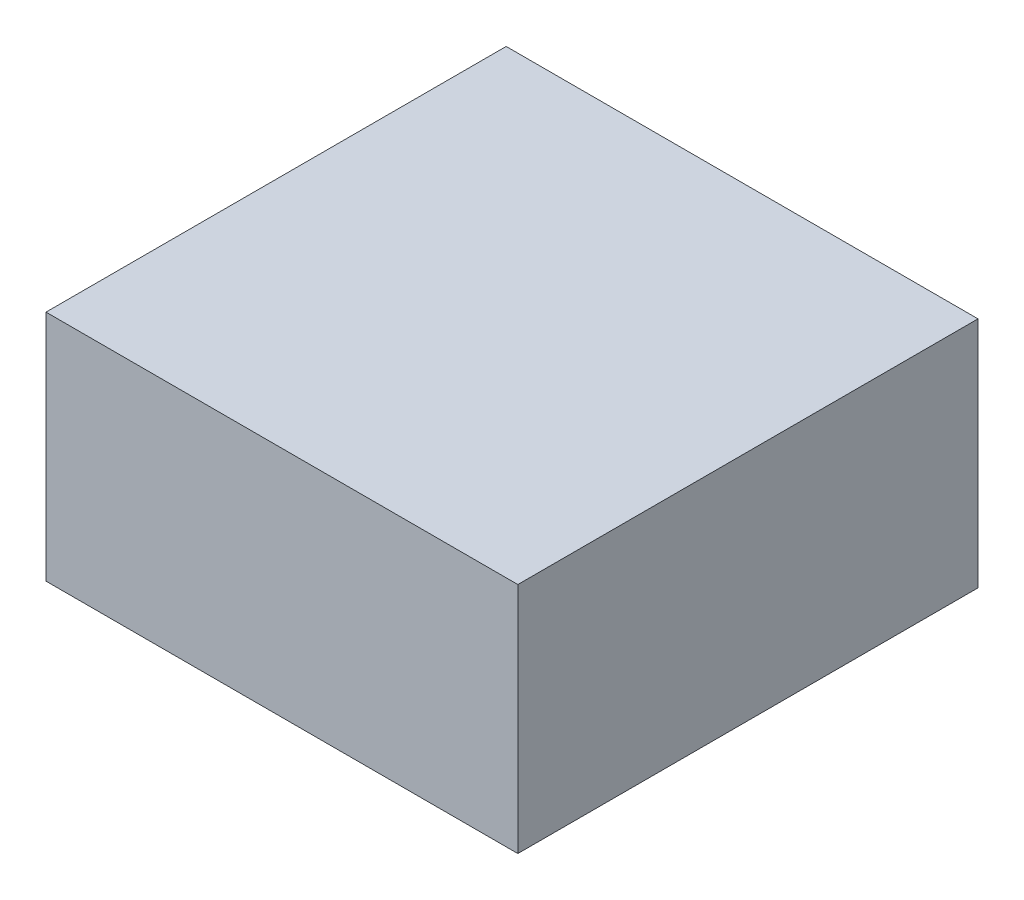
SolidWorks part; units mm, degrees
ref_plane "前视基准面" through (0, 0, 0) normal (0, 0, 1) x (1, 0, 0)
ref_plane "上视基准面" through (0, 0, 0) normal (0, 1, 0) x (1, 0, 0)
ref_plane "右视基准面" through (0, 0, 0) normal (1, 0, 0) x (0, 0, -1)
other "Configuration Table"
sketch "草图1" plane through (0, 0, 0) normal (0, 0, 1) x (1, 0, 0)
  line L1 (-10, -10) -> (30.5, -10)
  line L2 (-10, -10) -> (-10, 10)
  line L3 (-10, 10) -> (30.5, 10)
  line L4 (30.5, -10) -> (30.5, 10)
extrude "MG995_SUPPLIER_40p5x20x39p5" add sketch "草图1" along normal blind 39.5
